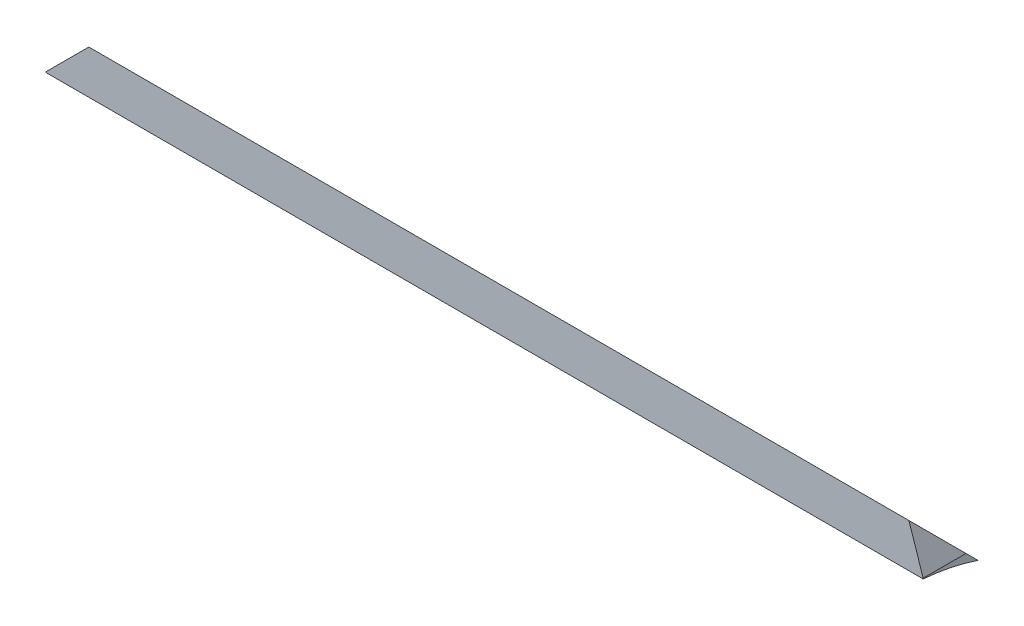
SolidWorks part; units mm, degrees
ref_plane "Front Plane" through (0, 0, 0) normal (0, 0, 1) x (1, 0, 0)
ref_plane "Top Plane" through (0, 0, 0) normal (0, 1, 0) x (1, 0, 0)
ref_plane "Right Plane" through (0, 0, 0) normal (1, 0, 0) x (0, 0, -1)
sketch "Sketch1" plane through (0, 0, 0) normal (0, 1, 0) x (1, 0, 0)
  line L1 (0, 0) -> (152.4, 0)
  line L2 (0, 0) -> (0, 12.7)
  line L3 (0, 12.7) -> (152.4, 12.7)
  line L4 (152.4, 0) -> (152.4, 12.7)
  dimension "D1" = 152.4
  dimension "D2" = 12.7
extrude "Extrude1" add sketch "Sketch1" along normal blind 12.7
sketch "Sketch2" plane through (152.4, 0, 0) normal (1, 0, 0) x (0, 0, -1)
  line L0 (0, 12.7) -> (12.7, 0)
  line L1 (0, 12.7) -> (12.7, 12.7)
  line L2 (12.7, 12.7) -> (12.7, 0)
extrude "Cut-Extrude1" cut sketch "Sketch2" against normal through all
sketch "Sketch3" plane through (152.4, 0, 0) normal (1, 0, 0) x (0, 0, -1)
  line L0 (0, 2.0869) -> (0, 22.1081)
  line L1 (0, 22.1081) -> (3.175, 22.1081)
  line L2 (3.175, 22.1081) -> (3.175, 1.9597)
  arc A0 (0, 2.0869) -> (3.175, 1.9597) centre (0, -37.6006) ccw
  dimension "D1" = 39.6875
  dimension "D2" = 3.175
extrude "Cut-Extrude2" cut sketch "Sketch3" against normal through all
sketch "Sketch5" plane through (0, 0, 0) normal (0, 0, 1) x (1, 0, 0)
  line L0 (152.4, 2.0869) -> (152.4, 0)
  line L1 (152.4, 2.0869) -> (127, 78.2869)
  line L2 (127, 78.2869) -> (76.2, 78.2869)
  line L3 (76.2, 78.2869) -> (0, 2.0869)
  line L4 (152.4, 0) -> (0, 0)
  line L5 (0, 0) -> (0, 2.0869)
  dimension "D1" = 152.4
  dimension "D2" = 25.4
  dimension "D4" = 76.2
extrude "Cut-Extrude7" cut sketch "Sketch5" against normal through all flip side to cut
